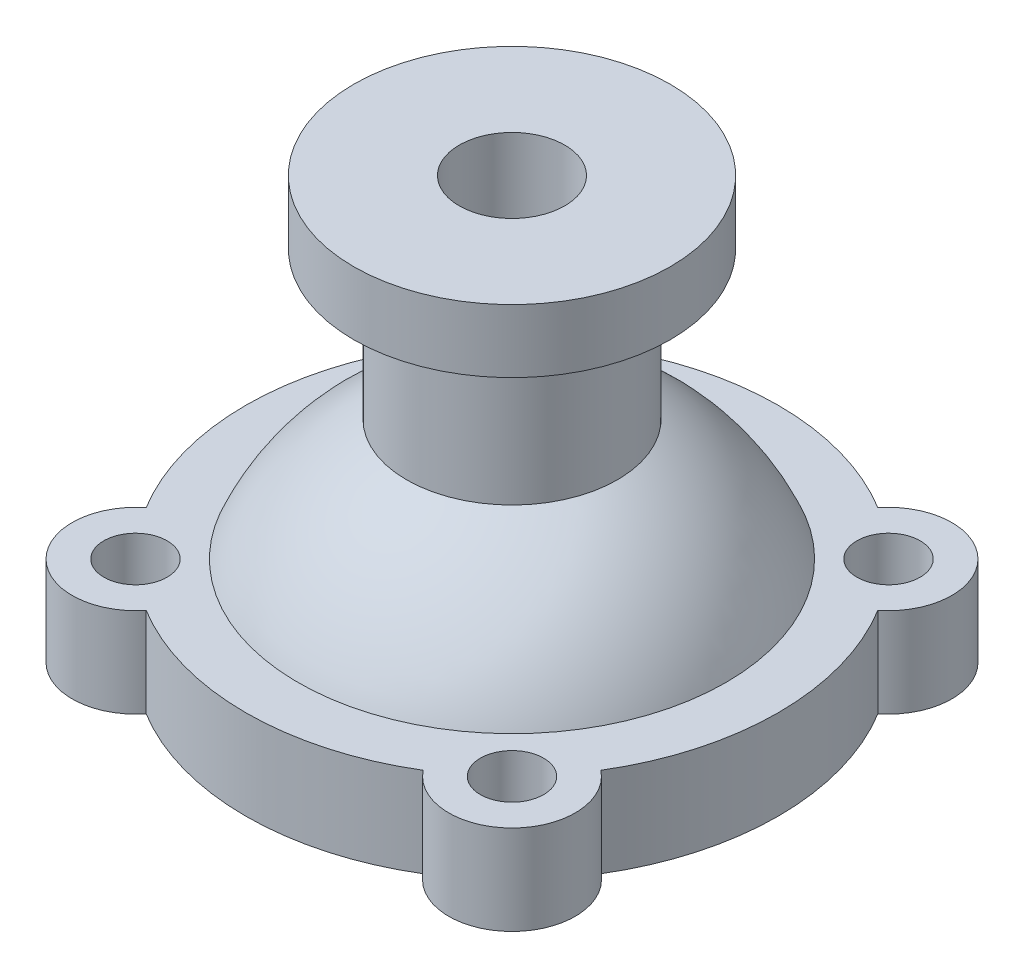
SolidWorks part; units mm, degrees
ref_plane "前视基准面" through (0, 0, 0) normal (0, 0, 1) x (1, 0, 0)
ref_plane "上视基准面" through (0, 0, 0) normal (0, 1, 0) x (1, 0, 0)
ref_plane "右视基准面" through (0, 0, 0) normal (1, 0, 0) x (0, 0, -1)
sketch "草图1" plane through (0, 0, 0) normal (0, 1, 0) x (1, 0, 0)
  line L0 (92.5164, 92.5164) -> (-92.7062, -92.7062) construction
  line L1 (-95.4625, 95.4625) -> (95.9443, -95.9443) construction
  line L2 (0, 76.7342) -> (0, -45.1884) construction
  arc A0 (52.5511, 86.2518) -> (-52.5511, 86.2518) centre (0, 0) ccw
  arc A1 (86.2518, 52.5511) -> (52.5511, 86.2518) centre (71.4178, 71.4178) ccw
  arc A2 (52.5511, -86.2518) -> (86.2518, -52.5511) centre (71.4178, -71.4178) ccw
  arc A3 (-52.5511, 86.2518) -> (-86.2518, 52.5511) centre (-71.4178, 71.4178) ccw
  arc A4 (-86.2518, -52.5511) -> (-52.5511, -86.2518) centre (-71.4178, -71.4178) ccw
  arc A5 (86.2518, -52.5511) -> (86.2518, 52.5511) centre (0, 0) ccw
  arc A6 (-52.5511, -86.2518) -> (52.5511, -86.2518) centre (0, 0) ccw
  arc A7 (-86.2518, 52.5511) -> (-86.2518, -52.5511) centre (0, 0) ccw
  circle A8 centre (-71.4178, 71.4178) radius 12
  circle A9 centre (71.4178, 71.4178) radius 12
  circle A10 centre (71.4178, -71.4178) radius 12
  circle A11 centre (-71.4178, -71.4178) radius 12
  dimension "D1" = 90
  dimension "D2" = 45
extrude "拉伸1" add sketch "草图1" along normal blind 34
sketch "草图2" plane through (0, 0, 0) normal (0, 0, 1) x (1, 0, 0)
  line L0 (-52.5511, 0) -> (52.5511, 0) construction
  line L1 (0, 74) -> (0, 88)
  line L2 (65.7267, 34) -> (81.1665, 34)
  line L4 (95.4178, 34) -> (52.5511, 34) construction
  line L5 (0, 55.3169) -> (0, 25.3548) construction
  arc A0 (65.7267, 34) -> (0, 74) centre (0, 0) ccw
  arc A1 (81.1665, 34) -> (0, 88) centre (0, 0) ccw
revolve "旋转1" add sketch "草图2" angle 360 about L5
sketch "草图3" plane through (0, 0, 0) normal (0, 0, 1) x (1, 0, 0)
  line L0 (0, 74) -> (0, 0)
  line L1 (0, 0) -> (74, 0)
  line L2 (0, -8.1455) -> (0, -32.6338) construction
  arc A0 (74, 0) -> (0, 74) centre (0, 0) ccw
revolve "切除-旋转1" cut sketch "草图3" angle 360 about L2
ref_plane "基准面1" through (0, 80, 0) normal (0, 1, 0) x (-1, 0, 0)
sketch "草图4" plane through (0, 80, 0) normal (0, 1, 0) x (-1, 0, 0)
  circle A0 centre (0, 0) radius 40
extrude "拉伸2" add sketch "草图4" along normal blind 56
sketch "草图5" plane through (0, 136, 0) normal (0, 1, 0) x (1, 0, 0)
  circle A0 centre (0, 0) radius 60
extrude "拉伸3" add sketch "草图5" along normal blind 24
sketch "草图6" plane through (0, 160, 0) normal (0, 1, 0) x (1, 0, 0)
  circle A0 centre (0, 0) radius 20
extrude "切除-拉伸1" cut sketch "草图6" against normal through all
